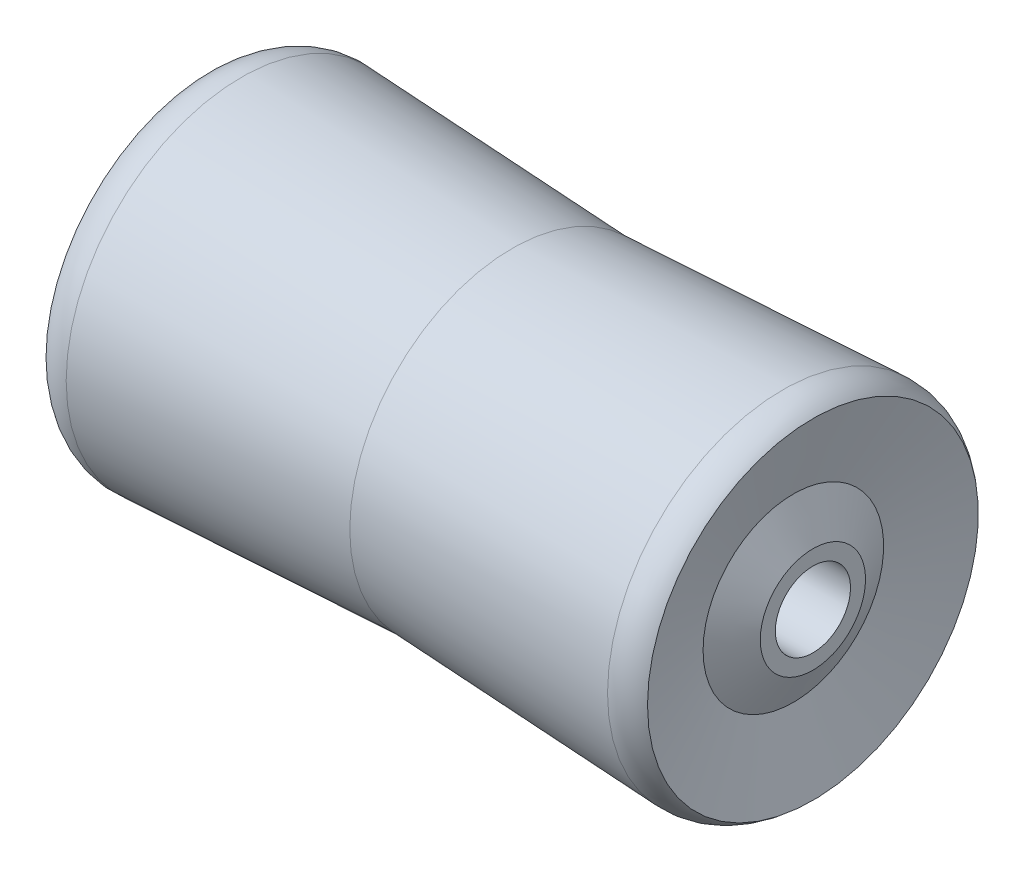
SolidWorks part; units mm, degrees
ref_plane "Plan de face" through (0, 0, 0) normal (0, 0, 1) x (1, 0, 0)
ref_plane "Plan de dessus" through (0, 0, 0) normal (0, 1, 0) x (1, 0, 0)
ref_plane "Plan de droite" through (0, 0, 0) normal (1, 0, 0) x (0, 0, -1)
sketch "Esquisse1" plane through (0, 0, 0) normal (0, 0, 1) x (1, 0, 0)
  line L0 (-100, 55) -> (-93.5, 30.0201)
  line L1 (-100, 12.5) -> (100, 12.5)
  line L2 (100, 12.5) -> (100, 17.5)
  line L3 (100, 17.5) -> (93.5, 30.0201)
  line L4 (93.5, 30.0201) -> (100, 55)
  line L5 (-93.5, 30.0201) -> (-100, 55)
  line L6 (-100, 17.5) -> (-93.5, 30.0201)
  line L7 (-100, 0) -> (100, 0) construction
  line L8 (100, 55) -> (93.5, 30.0201)
  line L9 (0, 0) -> (0, 84.4037) construction
  line L10 (-100, 12.5) -> (-100, 17.5)
  arc A0 (0, 54) -> (-90, 58.2942) centre (2.6109, 1053.9966) cw
  arc A1 (100, 55) -> (90, 58.2942) centre (91.2204, 45.1736) ccw
  arc A2 (0, 54) -> (90, 58.2942) centre (-2.6109, 1053.9966) ccw
  arc A3 (-100, 55) -> (-90, 58.2942) centre (-91.2204, 45.1736) cw
  point P21 (0, 12.5)
  dimension "D8" = 13.1773
  dimension "D7" = 1000
  dimension "D11" = 90
  dimension "D2" = 25
  dimension "D3" = 100
  dimension "D4" = 17.5
  dimension "D5" = 30.0201
  dimension "D6" = 55
  dimension "D9" = 137.978
  dimension "D10" = 54
  dimension "D12" = 93.5
revolve "Révolution4" add sketch "Esquisse1" angle 360 about L7
